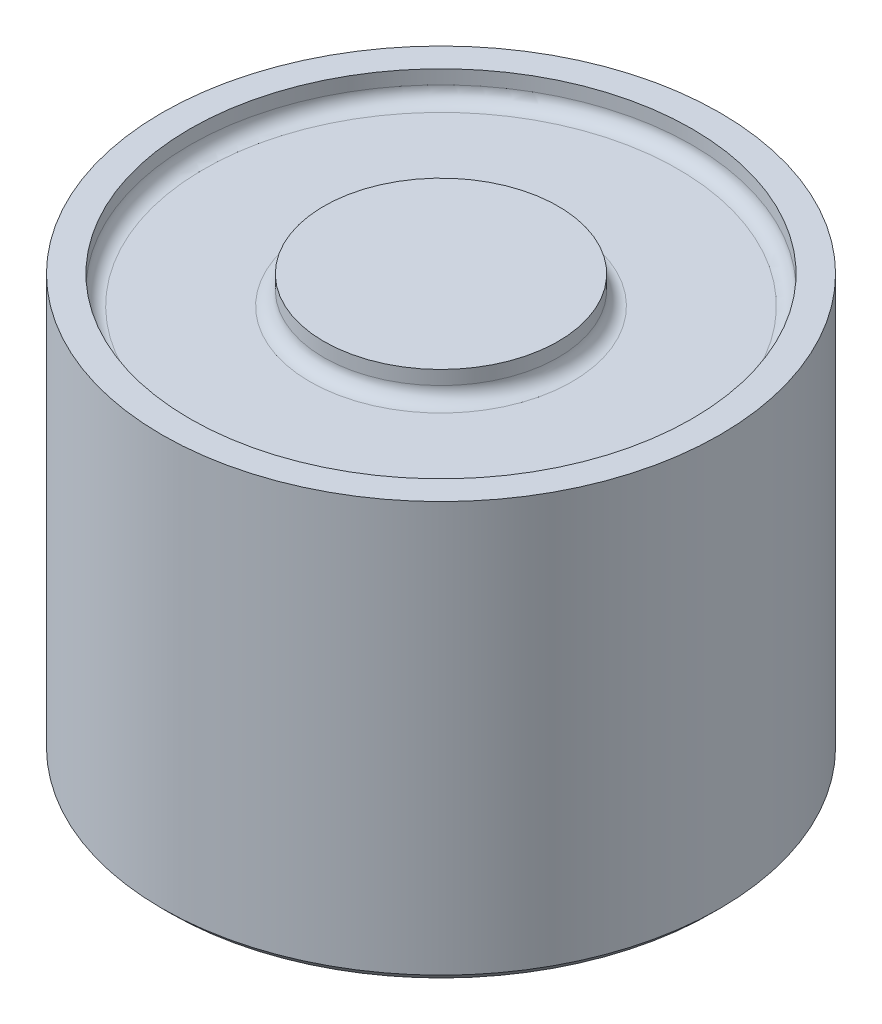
SolidWorks part; units mm, degrees
ref_plane "Plan de face" through (0, 0, 0) normal (0, 0, 1) x (1, 0, 0)
ref_plane "Plan de dessus" through (0, 0, 0) normal (0, 1, 0) x (1, 0, 0)
ref_plane "Plan de droite" through (0, 0, 0) normal (1, 0, 0) x (0, 0, -1)
sketch "Esquisse1" plane through (0, 0, 0) normal (0, 1, 0) x (1, 0, 0)
  circle A0 centre (0, 0) radius 10
extrude "Boss.-Extru.1" add sketch "Esquisse1" along normal blind 15
sketch "Esquisse2" plane through (0, 15, 0) normal (0, 1, 0) x (1, 0, 0)
  circle A0 centre (0, 0) radius 9
  circle A1 centre (0, 0) radius 4.2
extrude "Enlèv. mat.-Extru.1" cut sketch "Esquisse2" against normal blind 1
fillet "Congé1" radius 0.5 2 edges at (0, 14, 4.2) (0, 14, 9)
sketch "Esquisse3" plane through (0, 0, 0) normal (0, -1, 0) x (1, 0, 0)
  circle A0 centre (0, 0) radius 5 construction
  circle A1 centre (0, -5) radius 1.4
  circle A2 centre (-4.3301, 2.5) radius 1.4
  circle A3 centre (4.3301, 2.5) radius 1.4
  dimension "D1" = 3
extrude "Enlèv. mat.-Extru.2" cut sketch "Esquisse3" against normal blind 4
chamfer "Chanfrein1" distance 0.3 angle 45 1 edges at (0, 0, 10)
